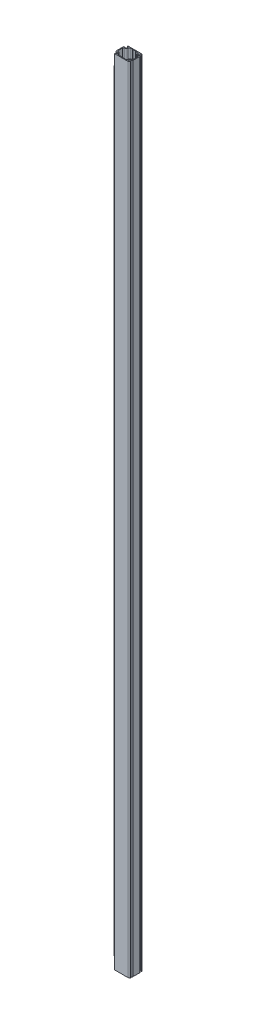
SolidWorks part; units mm, degrees
ref_plane "Alzado" through (0, 0, 0) normal (0, 0, 1) x (1, 0, 0)
ref_plane "Planta" through (0, 0, 0) normal (0, 1, 0) x (1, 0, 0)
ref_plane "Vista lateral" through (0, 0, 0) normal (1, 0, 0) x (0, 0, -1)
sketch "Croquis1" plane through (0, 0, 0) normal (0, 1, 0) x (1, 0, 0)
  line L0 (0, -75.4262) -> (0, 70.5479) construction
  line L1 (-123.9156, -11.6543) -> (129.4204, -11.6543) construction
  line L6 (39.5, 1.486) -> (39.5, 34.9397) construction
  line L7 (19.5039, 17.8457) -> (63.5704, 17.8457) construction
  line L9 (46, -42.8837) -> (46, -42.6992)
  line L10 (22.5, 24.3457) -> (12.5, 24.3457)
  line L12 (39.5, 17.8457) -> (50.0765, 20.3595) construction
  line L13 (47.3463, 21.5924) -> (48.0388, 18.6787) construction
  line L14 (47.3463, -44.9011) -> (48.0388, -41.9874) construction
  line L15 (39.5, -41.1543) -> (50.0765, -43.6682) construction
  line L16 (19.5039, -41.1543) -> (63.5704, -41.1543) construction
  line L17 (39.5, -24.7947) -> (39.5, -58.2483) construction
  line L19 (46, 19.5751) -> (46, 19.3906)
  line L20 (39.5, -51.6543) -> (-39.5, -51.6543)
  line L21 (11, 22.8457) -> (12.5, 24.3457)
  line L22 (46, -24.1543) -> (46, 0.8457)
  line L23 (50, -31.9348) -> (50, 8.6261)
  line L24 (-39.5, -24.7947) -> (-39.5, -58.2483) construction
  line L25 (-19.5039, -41.1543) -> (-63.5704, -41.1543) construction
  line L26 (-39.5, -41.1543) -> (-50.0765, -43.6682) construction
  line L27 (-47.3463, -44.9011) -> (-48.0388, -41.9874) construction
  line L28 (-47.3463, 21.5924) -> (-48.0388, 18.6787) construction
  line L29 (-39.5, 17.8457) -> (-50.0765, 20.3595) construction
  line L30 (-19.5039, 17.8457) -> (-63.5704, 17.8457) construction
  line L31 (-39.5, 1.486) -> (-39.5, 34.9397) construction
  line L32 (123.9156, -11.6543) -> (-129.4204, -11.6543) construction
  line L33 (-50, -31.9348) -> (-50, 8.6261)
  line L34 (-46, -24.1543) -> (-46, 0.8457)
  line L35 (-50, 28.3457) -> (-50, -31.9348)
  line L36 (-39.5, -51.6543) -> (39.5, -51.6543)
  line L38 (-22.5, -47.6543) -> (-12.5, -47.6543)
  line L39 (-22.5, 24.3457) -> (-12.5, 24.3457)
  line L40 (-46, -42.8837) -> (-46, -42.6992)
  line L41 (-39.5, 28.3457) -> (39.5, 28.3457)
  line L42 (46, 0.8457) -> (46, -24.1543)
  line L43 (50, 8.6261) -> (50, -31.9348)
  line L44 (8, 22.8457) -> (6.5, 24.3457)
  line L45 (11, 22.8457) -> (8, 22.8457)
  line L46 (-11, 22.8457) -> (-8, 22.8457)
  line L47 (-8, 22.8457) -> (-6.5, 24.3457)
  line L48 (-11, 22.8457) -> (-12.5, 24.3457)
  line L49 (11, -46.1543) -> (8, -46.1543)
  line L50 (8, -46.1543) -> (6.5, -47.6543)
  line L51 (11, -46.1543) -> (12.5, -47.6543)
  line L52 (-11, -46.1543) -> (-12.5, -47.6543)
  line L53 (-8, -46.1543) -> (-6.5, -47.6543)
  line L54 (-11, -46.1543) -> (-8, -46.1543)
  line L55 (-6.5, -47.6543) -> (6.5, -47.6543)
  line L56 (12.5, -47.6543) -> (22.5, -47.6543)
  line L57 (-12.5, 24.3457) -> (-22.5, 24.3457)
  line L58 (6.5, 24.3457) -> (-6.5, 24.3457)
  line L59 (-6.5, 24.3457) -> (6.5, 24.3457)
  line L60 (12.5, 24.3457) -> (22.5, 24.3457)
  line L61 (-46, 0.8457) -> (-46, -24.1543)
  arc A0 (49.242, 21.7627) -> (39.5, 28.3457) centre (39.5, 17.8457) ccw
  arc A1 (45.5308, 20.2705) -> (43.0455, 12.3978) centre (39.5, 17.8457) ccw
  arc A5 (45.5308, 20.2705) -> (49.242, 21.7627) centre (47.3864, 21.0166) ccw
  arc A6 (29, 17.8457) -> (22.5, 24.3457) centre (22.5, 17.8457) ccw
  arc A7 (46, 0.8457) -> (39.5, 7.3457) centre (39.5, 0.8457) ccw
  arc A9 (50, 8.6261) -> (43.0455, 12.3978) centre (45.5, 8.6261) ccw
  arc A10 (50, -31.9348) -> (43.0455, -35.7064) centre (45.5, -31.9348) cw
  arc A11 (46, -24.1543) -> (39.5, -30.6543) centre (39.5, -24.1543) cw
  arc A12 (29, -41.1543) -> (22.5, -47.6543) centre (22.5, -41.1543) cw
  arc A13 (45.5308, -43.5791) -> (49.242, -45.0713) centre (47.3864, -44.3252) cw
  arc A14 (45.5308, -43.5791) -> (43.0455, -35.7064) centre (39.5, -41.1543) cw
  arc A15 (49.242, -45.0713) -> (39.5, -51.6543) centre (39.5, -41.1543) cw
  arc A16 (29, -41.1543) -> (39.5, -30.6543) centre (39.5, -41.1543) cw
  arc A17 (29, 17.8457) -> (39.5, 7.3457) centre (39.5, 17.8457) ccw
  arc A18 (-29, 17.8457) -> (-39.5, 7.3457) centre (-39.5, 17.8457) cw
  arc A19 (-29, -41.1543) -> (-39.5, -30.6543) centre (-39.5, -41.1543) ccw
  arc A20 (-49.242, -45.0713) -> (-39.5, -51.6543) centre (-39.5, -41.1543) ccw
  arc A21 (-45.5308, -43.5791) -> (-43.0455, -35.7064) centre (-39.5, -41.1543) ccw
  arc A22 (-45.5308, -43.5791) -> (-49.242, -45.0713) centre (-47.3864, -44.3252) ccw
  arc A23 (-29, -41.1543) -> (-22.5, -47.6543) centre (-22.5, -41.1543) ccw
  arc A24 (-46, -24.1543) -> (-39.5, -30.6543) centre (-39.5, -24.1543) ccw
  arc A25 (-50, -31.9348) -> (-43.0455, -35.7064) centre (-45.5, -31.9348) ccw
  arc A26 (-50, 8.6261) -> (-43.0455, 12.3978) centre (-45.5, 8.6261) cw
  arc A27 (-46, 0.8457) -> (-39.5, 7.3457) centre (-39.5, 0.8457) cw
  arc A28 (-29, 17.8457) -> (-22.5, 24.3457) centre (-22.5, 17.8457) cw
  arc A29 (-45.5308, 20.2705) -> (-49.242, 21.7627) centre (-47.3864, 21.0166) cw
  arc A30 (-45.5308, 20.2705) -> (-43.0455, 12.3978) centre (-39.5, 17.8457) cw
  arc A31 (-49.242, 21.7627) -> (-39.5, 28.3457) centre (-39.5, 17.8457) cw
  dimension "D8" = 2
  dimension "D9" = 13
  dimension "D12" = 4.5
  dimension "D2" = 8
  dimension "D3" = 11.6543
  dimension "D4" = 3
  dimension "D5" = 45
  dimension "D6" = 45
  dimension "D10" = 13.37
  dimension "D11" = 8.5
  dimension "D13" = 3.1709
  dimension "D14" = 9.2195
extrude "Saliente-Extruir1" add sketch "Croquis1" along normal blind 4753 contours A31 A29 A30 A26 L33 A25 A21 A22 A20 L20 A15 A13 A14 A10 L23 A9 A1 A5 A0 L41 A18 A28 L39 L48 L46 L47 L58 L44 L45 L21 L10 A6 A17 A7 L22 A11 A16 A12 L56 L51 L49 L50 L55 L53 L54 L52 L38
sketch "Croquis2" plane through (0, 4753, 0) normal (0, 1, 0) x (1, 0, 0)
  line L0 (-39.5, 17.8457) -> (-39.5, 28.3457)
  line L1 (-39.5, 28.3457) -> (-52.3182, 28.3457)
  line L2 (-52.3182, 28.3457) -> (-52.3182, 17.8457)
  line L3 (-52.3182, 17.8457) -> (-39.5, 17.8457)
  line L4 (0, 0) -> (0, -36.1189) construction
  line L11 (-52.3182, -41.1543) -> (-39.5, -41.1543)
  line L12 (-52.3182, -51.6543) -> (-52.3182, -41.1543)
  line L13 (-39.5, -51.6543) -> (-52.3182, -51.6543)
  line L14 (-39.5, -41.1543) -> (-39.5, -51.6543)
  arc A0 (-39.5, 28.3457) -> (-49.242, 21.7627) centre (-39.5, 17.8457) ccw construction
extrude "Cortar-Extruir1" cut sketch "Croquis2" against normal blind 70
sketch "Croquis4" plane through (0, 0, 0) normal (0, -1, 0) x (-1, 0, 0)
  line L0 (39.5, -41.1543) -> (39.5, -51.6543)
  line L1 (39.5, -51.6543) -> (56.3074, -51.6543)
  line L2 (39.5, -41.1543) -> (56.3074, -41.1543)
  line L3 (56.3074, -41.1543) -> (56.3074, -51.6543)
  line L4 (0, 0) -> (0, -26.2166) construction
  line L12 (39.5, 17.8457) -> (39.5, 28.3457)
  line L13 (56.3074, 17.8457) -> (56.3074, 28.3457)
  line L14 (39.5, 17.8457) -> (56.3074, 17.8457)
  line L15 (39.5, 28.3457) -> (56.3074, 28.3457)
extrude "Cortar-Extruir2" cut sketch "Croquis4" against normal blind 70
